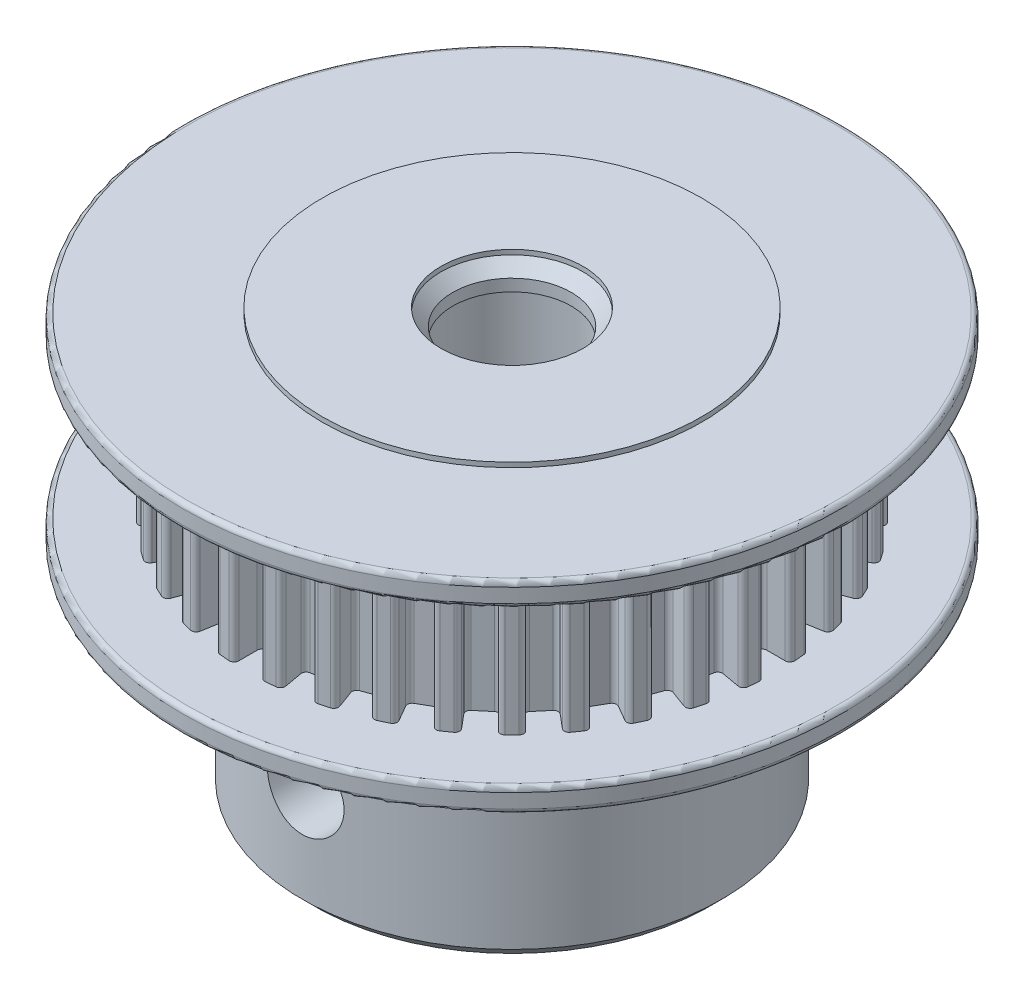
SolidWorks part; units mm, degrees
ref_plane "Ebene vorne" through (0, 0, 0) normal (0, 0, 1) x (1, 0, 0)
ref_plane "Ebene oben" through (0, 0, 0) normal (0, 1, 0) x (1, 0, 0)
ref_plane "Ebene rechts" through (0, 0, 0) normal (1, 0, 0) x (0, 0, -1)
imported_body "Importiert3"
sketch "Skizze1" plane through (10.9432, 0, -1.9296) normal (0.9848, 0, -0.1736) x (-0.1736, 0, -0.9848)
  line L0 (-0.55, 10) -> (0.55, 10)
  line L1 (0.55, 10) -> (0.55, 16.5)
  line L2 (0.55, 16.5) -> (-0.55, 16.5)
  line L3 (-0.55, 16.5) -> (-0.55, 10)
extrude "Schnitt-Linear austragen1" cut sketch "Skizze1" against normal blind 1.112
sketch "Skizze2" plane through (10.9432, 0, 1.9296) normal (0.9848, 0, 0.1736) x (0.1736, 0, -0.9848)
  line L0 (-0.55, 10) -> (0.55, 10)
  line L1 (0.55, 10) -> (0.55, 16.5)
  line L2 (0.55, 16.5) -> (-0.55, 16.5)
  line L3 (-0.55, 16.5) -> (-0.55, 10)
extrude "Schnitt-Linear austragen2" cut sketch "Skizze2" against normal blind 1.112
sketch "Skizze3" plane through (10.4419, 0, -3.8005) normal (0.9397, 0, -0.342) x (-0.342, 0, -0.9397)
  line L0 (-0.55, 10) -> (0.55, 10)
  line L1 (0.55, 10) -> (0.55, 16.5)
  line L2 (0.55, 16.5) -> (-0.55, 16.5)
  line L3 (-0.55, 16.5) -> (-0.55, 10)
extrude "Schnitt-Linear austragen3" cut sketch "Skizze3" against normal blind 1.112
sketch "Skizze4" plane through (10.4419, 0, 3.8005) normal (0.9397, 0, 0.342) x (0.342, 0, -0.9397)
  line L0 (-0.55, 10) -> (0.55, 10)
  line L1 (0.55, 10) -> (0.55, 16.5)
  line L2 (0.55, 16.5) -> (-0.55, 16.5)
  line L3 (-0.55, 16.5) -> (-0.55, 10)
extrude "Schnitt-Linear austragen4" cut sketch "Skizze4" against normal blind 1.112
sketch "Skizze5" plane through (9.6233, 0, -5.556) normal (0.866, 0, -0.5) x (-0.5, 0, -0.866)
  line L0 (-0.55, 10) -> (0.55, 10)
  line L1 (0.55, 10) -> (0.55, 16.5)
  line L2 (0.55, 16.5) -> (-0.55, 16.5)
  line L3 (-0.55, 16.5) -> (-0.55, 10)
extrude "Schnitt-Linear austragen5" cut sketch "Skizze5" against normal blind 1.112
sketch "Skizze6" plane through (9.6233, 0, 5.556) normal (0.866, 0, 0.5) x (0.5, 0, -0.866)
  line L0 (-0.55, 10) -> (0.55, 10)
  line L1 (0.55, 10) -> (0.55, 16.5)
  line L2 (0.55, 16.5) -> (-0.55, 16.5)
  line L3 (-0.55, 16.5) -> (-0.55, 10)
extrude "Schnitt-Linear austragen6" cut sketch "Skizze6" against normal blind 1.112
sketch "Skizze7" plane through (8.5123, 0, -7.1427) normal (0.766, 0, -0.6428) x (-0.6428, 0, -0.766)
  line L0 (-0.55, 10) -> (0.55, 10)
  line L1 (0.55, 10) -> (0.55, 16.5)
  line L2 (0.55, 16.5) -> (-0.55, 16.5)
  line L3 (-0.55, 16.5) -> (-0.55, 10)
extrude "Schnitt-Linear austragen7" cut sketch "Skizze7" against normal blind 1.112
sketch "Skizze8" plane through (8.5123, 0, 7.1427) normal (0.766, 0, 0.6428) x (0.6428, 0, -0.766)
  line L0 (-0.55, 10) -> (0.55, 10)
  line L1 (0.55, 10) -> (0.55, 16.5)
  line L2 (0.55, 16.5) -> (-0.55, 16.5)
  line L3 (-0.55, 16.5) -> (-0.55, 10)
extrude "Schnitt-Linear austragen8" cut sketch "Skizze8" against normal blind 1.112
sketch "Skizze9" plane through (7.1427, 0, -8.5123) normal (0.6428, 0, -0.766) x (-0.766, 0, -0.6428)
  line L0 (-0.55, 10) -> (0.55, 10)
  line L1 (0.55, 10) -> (0.55, 16.5)
  line L2 (0.55, 16.5) -> (-0.55, 16.5)
  line L3 (-0.55, 16.5) -> (-0.55, 10)
extrude "Schnitt-Linear austragen9" cut sketch "Skizze9" against normal blind 1.112
sketch "Skizze10" plane through (7.1427, 0, 8.5123) normal (0.6428, 0, 0.766) x (0.766, 0, -0.6428)
  line L0 (-0.55, 10) -> (0.55, 10)
  line L1 (0.55, 10) -> (0.55, 16.5)
  line L2 (0.55, 16.5) -> (-0.55, 16.5)
  line L3 (-0.55, 16.5) -> (-0.55, 10)
extrude "Schnitt-Linear austragen10" cut sketch "Skizze10" against normal blind 1.112
sketch "Skizze11" plane through (5.556, 0, -9.6233) normal (0.5, 0, -0.866) x (-0.866, 0, -0.5)
  line L0 (-0.55, 10) -> (0.55, 10)
  line L1 (0.55, 10) -> (0.55, 16.5)
  line L2 (0.55, 16.5) -> (-0.55, 16.5)
  line L3 (-0.55, 16.5) -> (-0.55, 10)
extrude "Schnitt-Linear austragen11" cut sketch "Skizze11" against normal blind 1.112
sketch "Skizze12" plane through (5.556, 0, 9.6233) normal (0.5, 0, 0.866) x (0.866, 0, -0.5)
  line L0 (-0.55, 10) -> (0.55, 10)
  line L1 (0.55, 10) -> (0.55, 16.5)
  line L2 (0.55, 16.5) -> (-0.55, 16.5)
  line L3 (-0.55, 16.5) -> (-0.55, 10)
extrude "Schnitt-Linear austragen12" cut sketch "Skizze12" against normal blind 1.112
sketch "Skizze13" plane through (3.8005, 0, -10.4419) normal (0.342, 0, -0.9397) x (-0.9397, 0, -0.342)
  line L0 (-0.55, 10) -> (0.55, 10)
  line L1 (0.55, 10) -> (0.55, 16.5)
  line L2 (0.55, 16.5) -> (-0.55, 16.5)
  line L3 (-0.55, 16.5) -> (-0.55, 10)
extrude "Schnitt-Linear austragen13" cut sketch "Skizze13" against normal blind 1.112
sketch "Skizze14" plane through (3.8005, 0, 10.4419) normal (0.342, 0, 0.9397) x (0.9397, 0, -0.342)
  line L0 (-0.55, 10) -> (0.55, 10)
  line L1 (0.55, 10) -> (0.55, 16.5)
  line L2 (0.55, 16.5) -> (-0.55, 16.5)
  line L3 (-0.55, 16.5) -> (-0.55, 10)
extrude "Schnitt-Linear austragen14" cut sketch "Skizze14" against normal blind 1.112
sketch "Skizze15" plane through (1.9296, 0, -10.9432) normal (0.1736, 0, -0.9848) x (-0.9848, 0, -0.1736)
  line L0 (-0.55, 10) -> (0.55, 10)
  line L1 (0.55, 10) -> (0.55, 16.5)
  line L2 (0.55, 16.5) -> (-0.55, 16.5)
  line L3 (-0.55, 16.5) -> (-0.55, 10)
extrude "Schnitt-Linear austragen15" cut sketch "Skizze15" against normal blind 1.112
sketch "Skizze16" plane through (1.9296, 0, 10.9432) normal (0.1736, 0, 0.9848) x (0.9848, 0, -0.1736)
  line L0 (-0.55, 10) -> (0.55, 10)
  line L1 (0.55, 10) -> (0.55, 16.5)
  line L2 (0.55, 16.5) -> (-0.55, 16.5)
  line L3 (-0.55, 16.5) -> (-0.55, 10)
extrude "Schnitt-Linear austragen16" cut sketch "Skizze16" against normal blind 1.112
sketch "Skizze17" plane through (0, 0, -11.112) normal (0, 0, -1) x (-1, 0, 0)
  line L0 (-0.55, 10) -> (0.55, 10)
  line L1 (0.55, 10) -> (0.55, 16.5)
  line L2 (0.55, 16.5) -> (-0.55, 16.5)
  line L3 (-0.55, 16.5) -> (-0.55, 10)
extrude "Schnitt-Linear austragen17" cut sketch "Skizze17" against normal blind 1.112
sketch "Skizze18" plane through (0, 0, 11.112) normal (0, 0, 1) x (1, 0, 0)
  line L0 (-0.55, 10) -> (0.55, 10)
  line L1 (0.55, 10) -> (0.55, 16.5)
  line L2 (0.55, 16.5) -> (-0.55, 16.5)
  line L3 (-0.55, 16.5) -> (-0.55, 10)
extrude "Schnitt-Linear austragen18" cut sketch "Skizze18" against normal blind 1.112
sketch "Skizze19" plane through (-1.9296, 0, -10.9432) normal (-0.1736, 0, -0.9848) x (-0.9848, 0, 0.1736)
  line L0 (-0.55, 10) -> (0.55, 10)
  line L1 (0.55, 10) -> (0.55, 16.5)
  line L2 (0.55, 16.5) -> (-0.55, 16.5)
  line L3 (-0.55, 16.5) -> (-0.55, 10)
extrude "Schnitt-Linear austragen19" cut sketch "Skizze19" against normal blind 1.112
sketch "Skizze20" plane through (-1.9296, 0, 10.9432) normal (-0.1736, 0, 0.9848) x (0.9848, 0, 0.1736)
  line L0 (-0.55, 10) -> (0.55, 10)
  line L1 (0.55, 10) -> (0.55, 16.5)
  line L2 (0.55, 16.5) -> (-0.55, 16.5)
  line L3 (-0.55, 16.5) -> (-0.55, 10)
extrude "Schnitt-Linear austragen20" cut sketch "Skizze20" against normal blind 1.112
sketch "Skizze21" plane through (-3.8005, 0, -10.4419) normal (-0.342, 0, -0.9397) x (-0.9397, 0, 0.342)
  line L0 (-0.55, 10) -> (0.55, 10)
  line L1 (0.55, 10) -> (0.55, 16.5)
  line L2 (0.55, 16.5) -> (-0.55, 16.5)
  line L3 (-0.55, 16.5) -> (-0.55, 10)
extrude "Schnitt-Linear austragen21" cut sketch "Skizze21" against normal blind 1.112
sketch "Skizze22" plane through (-3.8005, 0, 10.4419) normal (-0.342, 0, 0.9397) x (0.9397, 0, 0.342)
  line L0 (-0.55, 10) -> (0.55, 10)
  line L1 (0.55, 10) -> (0.55, 16.5)
  line L2 (0.55, 16.5) -> (-0.55, 16.5)
  line L3 (-0.55, 16.5) -> (-0.55, 10)
extrude "Schnitt-Linear austragen22" cut sketch "Skizze22" against normal blind 1.112
sketch "Skizze23" plane through (-5.556, 0, -9.6233) normal (-0.5, 0, -0.866) x (-0.866, 0, 0.5)
  line L0 (-0.55, 10) -> (0.55, 10)
  line L1 (0.55, 10) -> (0.55, 16.5)
  line L2 (0.55, 16.5) -> (-0.55, 16.5)
  line L3 (-0.55, 16.5) -> (-0.55, 10)
extrude "Schnitt-Linear austragen23" cut sketch "Skizze23" against normal blind 1.112
sketch "Skizze24" plane through (-5.556, 0, 9.6233) normal (-0.5, 0, 0.866) x (0.866, 0, 0.5)
  line L0 (-0.55, 10) -> (0.55, 10)
  line L1 (0.55, 10) -> (0.55, 16.5)
  line L2 (0.55, 16.5) -> (-0.55, 16.5)
  line L3 (-0.55, 16.5) -> (-0.55, 10)
extrude "Schnitt-Linear austragen24" cut sketch "Skizze24" against normal blind 1.112
sketch "Skizze25" plane through (-7.1427, 0, -8.5123) normal (-0.6428, 0, -0.766) x (-0.766, 0, 0.6428)
  line L0 (-0.55, 10) -> (0.55, 10)
  line L1 (0.55, 10) -> (0.55, 16.5)
  line L2 (0.55, 16.5) -> (-0.55, 16.5)
  line L3 (-0.55, 16.5) -> (-0.55, 10)
extrude "Schnitt-Linear austragen25" cut sketch "Skizze25" against normal blind 1.112
sketch "Skizze26" plane through (-7.1427, 0, 8.5123) normal (-0.6428, 0, 0.766) x (0.766, 0, 0.6428)
  line L0 (-0.55, 10) -> (0.55, 10)
  line L1 (0.55, 10) -> (0.55, 16.5)
  line L2 (0.55, 16.5) -> (-0.55, 16.5)
  line L3 (-0.55, 16.5) -> (-0.55, 10)
extrude "Schnitt-Linear austragen26" cut sketch "Skizze26" against normal blind 1.112
sketch "Skizze27" plane through (-8.5123, 0, -7.1427) normal (-0.766, 0, -0.6428) x (-0.6428, 0, 0.766)
  line L0 (-0.55, 10) -> (0.55, 10)
  line L1 (0.55, 10) -> (0.55, 16.5)
  line L2 (0.55, 16.5) -> (-0.55, 16.5)
  line L3 (-0.55, 16.5) -> (-0.55, 10)
extrude "Schnitt-Linear austragen27" cut sketch "Skizze27" against normal blind 1.112
sketch "Skizze28" plane through (-8.5123, 0, 7.1427) normal (-0.766, 0, 0.6428) x (0.6428, 0, 0.766)
  line L0 (-0.55, 10) -> (0.55, 10)
  line L1 (0.55, 10) -> (0.55, 16.5)
  line L2 (0.55, 16.5) -> (-0.55, 16.5)
  line L3 (-0.55, 16.5) -> (-0.55, 10)
extrude "Schnitt-Linear austragen28" cut sketch "Skizze28" against normal blind 1.112
sketch "Skizze29" plane through (-9.6233, 0, -5.556) normal (-0.866, 0, -0.5) x (-0.5, 0, 0.866)
  line L0 (-0.55, 10) -> (0.55, 10)
  line L1 (0.55, 10) -> (0.55, 16.5)
  line L2 (0.55, 16.5) -> (-0.55, 16.5)
  line L3 (-0.55, 16.5) -> (-0.55, 10)
extrude "Schnitt-Linear austragen29" cut sketch "Skizze29" against normal blind 1.112
sketch "Skizze30" plane through (-9.6233, 0, 5.556) normal (-0.866, 0, 0.5) x (0.5, 0, 0.866)
  line L0 (-0.55, 10) -> (0.55, 10)
  line L1 (0.55, 10) -> (0.55, 16.5)
  line L2 (0.55, 16.5) -> (-0.55, 16.5)
  line L3 (-0.55, 16.5) -> (-0.55, 10)
extrude "Schnitt-Linear austragen30" cut sketch "Skizze30" against normal blind 1.112
sketch "Skizze31" plane through (-10.4419, 0, -3.8005) normal (-0.9397, 0, -0.342) x (-0.342, 0, 0.9397)
  line L0 (-0.55, 10) -> (0.55, 10)
  line L1 (0.55, 10) -> (0.55, 16.5)
  line L2 (0.55, 16.5) -> (-0.55, 16.5)
  line L3 (-0.55, 16.5) -> (-0.55, 10)
extrude "Schnitt-Linear austragen31" cut sketch "Skizze31" against normal blind 1.112
sketch "Skizze32" plane through (-10.4419, 0, 3.8005) normal (-0.9397, 0, 0.342) x (0.342, 0, 0.9397)
  line L0 (-0.55, 10) -> (0.55, 10)
  line L1 (0.55, 10) -> (0.55, 16.5)
  line L2 (0.55, 16.5) -> (-0.55, 16.5)
  line L3 (-0.55, 16.5) -> (-0.55, 10)
extrude "Schnitt-Linear austragen32" cut sketch "Skizze32" against normal blind 1.112
sketch "Skizze33" plane through (-10.9432, 0, -1.9296) normal (-0.9848, 0, -0.1736) x (-0.1736, 0, 0.9848)
  line L0 (-0.55, 10) -> (0.55, 10)
  line L1 (0.55, 10) -> (0.55, 16.5)
  line L2 (0.55, 16.5) -> (-0.55, 16.5)
  line L3 (-0.55, 16.5) -> (-0.55, 10)
extrude "Schnitt-Linear austragen33" cut sketch "Skizze33" against normal blind 1.112
sketch "Skizze34" plane through (-10.9432, 0, 1.9296) normal (-0.9848, 0, 0.1736) x (0.1736, 0, 0.9848)
  line L0 (-0.55, 10) -> (0.55, 10)
  line L1 (0.55, 10) -> (0.55, 16.5)
  line L2 (0.55, 16.5) -> (-0.55, 16.5)
  line L3 (-0.55, 16.5) -> (-0.55, 10)
extrude "Schnitt-Linear austragen34" cut sketch "Skizze34" against normal blind 1.112
sketch "Skizze35" plane through (-11.112, 0, 0) normal (-1, 0, 0) x (0, 0, 1)
  line L0 (-0.55, 10) -> (0.55, 10)
  line L1 (0.55, 10) -> (0.55, 16.5)
  line L2 (0.55, 16.5) -> (-0.55, 16.5)
  line L3 (-0.55, 16.5) -> (-0.55, 10)
extrude "Schnitt-Linear austragen35" cut sketch "Skizze35" against normal blind 1.112
sketch "Skizze36" plane through (11.112, 0, 0) normal (1, 0, 0) x (0, 0, -1)
  line L0 (-0.55, 10) -> (0.55, 10)
  line L1 (0.55, 10) -> (0.55, 16.5)
  line L2 (0.55, 16.5) -> (-0.55, 16.5)
  line L3 (-0.55, 16.5) -> (-0.55, 10)
extrude "Schnitt-Linear austragen36" cut sketch "Skizze36" against normal blind 1.112
ref_plane "Ebene1" through (0, 16.5, 0) normal (0, -1, 0) x (1, 0, 0)
sketch "Skizze37" plane through (0, 16.5, 0) normal (0, -1, 0) x (1, 0, 0)
  circle A0 centre (0, 0) radius 13.9
extrude "Aufsatz-Linear austragen1" add sketch "Skizze37" against normal blind 1
sketch "Skizze38" plane through (0, 9, 0) normal (0, -1, 0) x (1, 0, 0)
  circle A0 centre (0, 0) radius 8.85
extrude "Aufsatz-Linear austragen2" add sketch "Skizze38" along normal blind 9
ref_plane "Ebene2" through (0, 0, 0) normal (0, 0, -1) x (-1, 0, 0)
sketch "Skizze39" plane through (0, 0, 0) normal (0, 0, -1) x (-1, 0, 0)
  line L0 (-2.5, 0) -> (0, 0)
  line L1 (0, 0) -> (0, 17.5)
  line L2 (0, 17.5) -> (-3, 17.5)
  line L3 (-3, 17.5) -> (-2.5, 17)
  line L4 (-2.5, 17) -> (-2.5, 16.5)
  line L5 (-2.5, 16.5) -> (-3, 16.5)
  line L6 (-3, 16.5) -> (-3, 10)
  line L7 (-3, 10) -> (-2.5, 10)
  line L8 (-2.5, 10) -> (-2.5, 0)
  line L9 (0, 0) -> (0, 17.5) construction
revolve "Schnitt-Rotation1" cut sketch "Skizze39" angle 360 about L9
ref_plane "Ebene3" through (0, 0, 1.9004) normal (0, 0, -1) x (-1, 0, 0)
hole_wizard "Durchgangsloch für M31" positions "Skizze41" profile "Skizze40" hole size "M3" standard "ANSI Metrisch"
sketch "Skizze41" plane through (0, 0, 1.9004) normal (0, 0, -1) x (-1, 0, 0)
  point P0 (0.0034, 4.4907)
sketch "Skizze40" plane through (-0.0034, 4.4907, 1.9004) normal (1, 0, 0) x (0, 1, 0)
  line L0 (0, 0) -> (0, 11.9996)
  line L1 (0, 11.9996) -> (1.621, 11.9996)
  line L2 (1.621, 11.9996) -> (1.621, 0)
  line L5 (1.621, 0) -> (0, 0)
  line L11 (0, -6.35) -> (0, 107.95) construction
  dimension "Bohrerdurchmesser" = 3.242
  dimension "Bohrungstiefe" = 11.9996
ref_plane "Ebene4" through (-1.9004, 0, 0) normal (1, 0, 0) x (0, 0, -1)
hole_wizard "Durchgangsloch für M32" positions "Skizze43" profile "Skizze42" hole size "M3" standard "ANSI Metrisch"
sketch "Skizze43" plane through (-1.9004, 0, 0) normal (1, 0, 0) x (0, 0, -1)
  point P0 (0.0034, 4.4907)
sketch "Skizze42" plane through (-1.9004, 4.4907, -0.0034) normal (0, 1, 0) x (0, 0, -1)
  line L0 (0, 0) -> (0, 11.9996)
  line L1 (0, 11.9996) -> (1.621, 11.9996)
  line L2 (1.621, 11.9996) -> (1.621, 0)
  line L5 (1.621, 0) -> (0, 0)
  line L11 (0, -6.35) -> (0, 107.95) construction
  dimension "Bohrerdurchmesser" = 3.242
  dimension "Bohrungstiefe" = 11.9996
chamfer "Fase1" distance 0.5 angle 45 2 edges at (-2.5, 0, 0) (0, 0, -8.85)
fillet "Verrundung1" radius 0.2 148 edges at (10.3237, 13.25, -4.3428) (5.1169, 13.25, -9.9628) (1.4009, 13.25, -11.112) (-11.1865, 13.25, 0.55) (8.2158, 13.25, -7.6119) (-10, 13.25, 0.55) (11.112, 13.25, -1.4009) (-11.112, 13.25, 1.4009) (3.3092, 13.25, -10.7) (-10, 13.25, -0.55) (6.7692, 13.25, -8.9229) (-9.9436, 13.25, 1.1948) (9.4128, 13.25, -6.0696) (-11.1865, 13.25, -0.55) (10.921, 13.25, -2.4842) (-9.7526, 13.25, 2.2781) (0.55, 13.25, -10) (-11.112, 13.25, -1.4009) (2.2781, 13.25, -9.7526) (-10.921, 13.25, 2.4842) (3.937, 13.25, -9.2088) (-9.9436, 13.25, -1.1948) (5.4763, 13.25, -8.3853) (-10.7, 13.25, 3.3092) (6.8492, 13.25, -7.3069) (-9.7526, 13.25, -2.2781) (8.014, 13.25, -6.0066) (-9.585, 13.25, 2.9034) (8.9353, 13.25, -4.5237) (-10.921, 13.25, -2.4842) (9.585, 13.25, -2.9034) (-9.2088, 13.25, 3.937) (0, 9, -13.9) (-10.7, 13.25, -3.3092) (0, 17.5, 13.9) (-10.3237, 13.25, 4.3428) (0.55, 13.25, -11.1865) (-9.585, 13.25, -2.9034) (1.1948, 13.25, -9.9436) (-9.9628, 13.25, 5.1169) (2.4842, 13.25, -10.921) (-9.2088, 13.25, -3.937) (2.9034, 13.25, -9.585) (-8.9353, 13.25, 4.5237) (4.3428, 13.25, -10.3237) (-10.3237, 13.25, -4.3428) (4.5237, 13.25, -8.9353) (-8.3853, 13.25, 5.4763) (6.0696, 13.25, -9.4128) (-9.9628, 13.25, -5.1169) (6.0066, 13.25, -8.014) (-9.4128, 13.25, 6.0696) (7.6119, 13.25, -8.2158) (-8.9353, 13.25, -4.5237) (7.3069, 13.25, -6.8492) (-8.9229, 13.25, 6.7692) (8.9229, 13.25, -6.7692) (-8.3853, 13.25, -5.4763) (8.3853, 13.25, -5.4763) (-8.014, 13.25, 6.0066) (9.9628, 13.25, -5.1169) (-9.4128, 13.25, -6.0696) (9.2088, 13.25, -3.937) (-7.3069, 13.25, 6.8492) (10.7, 13.25, -3.3092) (-8.9229, 13.25, -6.7692) (9.7526, 13.25, -2.2781) (-8.2158, 13.25, 7.6119) (10, 13.25, 0.55) (-8.014, 13.25, -6.0066) (11.1865, 13.25, -0.55) (-7.6119, 13.25, 8.2158) (1.4009, 13.25, 11.112) (-7.3069, 13.25, -6.8492) (1.1948, 13.25, 9.9436) (-6.8492, 13.25, 7.3069) (2.2781, 13.25, 9.7526) (-8.2158, 13.25, -7.6119) (2.4842, 13.25, 10.921) (-6.0066, 13.25, 8.014) (3.3092, 13.25, 10.7) (-7.6119, 13.25, -8.2158) (2.9034, 13.25, 9.585) (-6.7692, 13.25, 8.9229) (3.937, 13.25, 9.2088) (-6.8492, 13.25, -7.3069) (4.3428, 13.25, 10.3237) (-6.0696, 13.25, 9.4128) (5.1169, 13.25, 9.9628) (-6.0066, 13.25, -8.014) (4.5237, 13.25, 8.9353) (-5.4763, 13.25, 8.3853) (5.4763, 13.25, 8.3853) (-6.7692, 13.25, -8.9229) (6.0696, 13.25, 9.4128) (-4.5237, 13.25, 8.9353) (6.7692, 13.25, 8.9229) (-6.0696, 13.25, -9.4128) (6.0066, 13.25, 8.014) (-5.1169, 13.25, 9.9628) (6.8492, 13.25, 7.3069) (-5.4763, 13.25, -8.3853) (7.6119, 13.25, 8.2158) (-4.3428, 13.25, 10.3237) (8.2158, 13.25, 7.6119) (-4.5237, 13.25, -8.9353) (7.3069, 13.25, 6.8492) (-3.937, 13.25, 9.2088) (8.014, 13.25, 6.0066) (-5.1169, 13.25, -9.9628) (8.9229, 13.25, 6.7692) (-2.9034, 13.25, 9.585) (9.4128, 13.25, 6.0696) (-4.3428, 13.25, -10.3237) (8.3853, 13.25, 5.4763) (-3.3092, 13.25, 10.7) (8.9353, 13.25, 4.5237) (-3.937, 13.25, -9.2088) (9.9628, 13.25, 5.1169) (-2.4842, 13.25, 10.921) (10.3237, 13.25, 4.3428) (-2.9034, 13.25, -9.585) (9.2088, 13.25, 3.937) (-2.2781, 13.25, 9.7526) (9.585, 13.25, 2.9034) (-3.3092, 13.25, -10.7) (10.7, 13.25, 3.3092) (-1.1948, 13.25, 9.9436) (10.921, 13.25, 2.4842) (-2.4842, 13.25, -10.921) (9.7526, 13.25, 2.2781) (-1.4009, 13.25, 11.112) (9.9436, 13.25, 1.1948) (-2.2781, 13.25, -9.7526) (11.112, 13.25, 1.4009) (-0.55, 13.25, 11.1865) (11.1865, 13.25, 0.55) (-1.1948, 13.25, -9.9436) (9.9436, 13.25, -1.1948) (-0.55, 13.25, 10) (0, 10, 13.9) (-1.4009, 13.25, -11.112) (10, 13.25, -0.55) (0.55, 13.25, 10) (0, 16.5, 13.9) (-0.55, 13.25, -11.1865) (-0.55, 13.25, -10) (0.55, 13.25, 11.1865)
sketch "Skizze49" plane through (0, 17.5, 0) normal (0, 1, 0) x (1, 0, 0)
  circle A0 centre (0, 0) radius 3
  circle A1 centre (0, 0) radius 8
extrude "Aufsatz-Linear austragen3" add sketch "Skizze49" along normal blind 0.2
